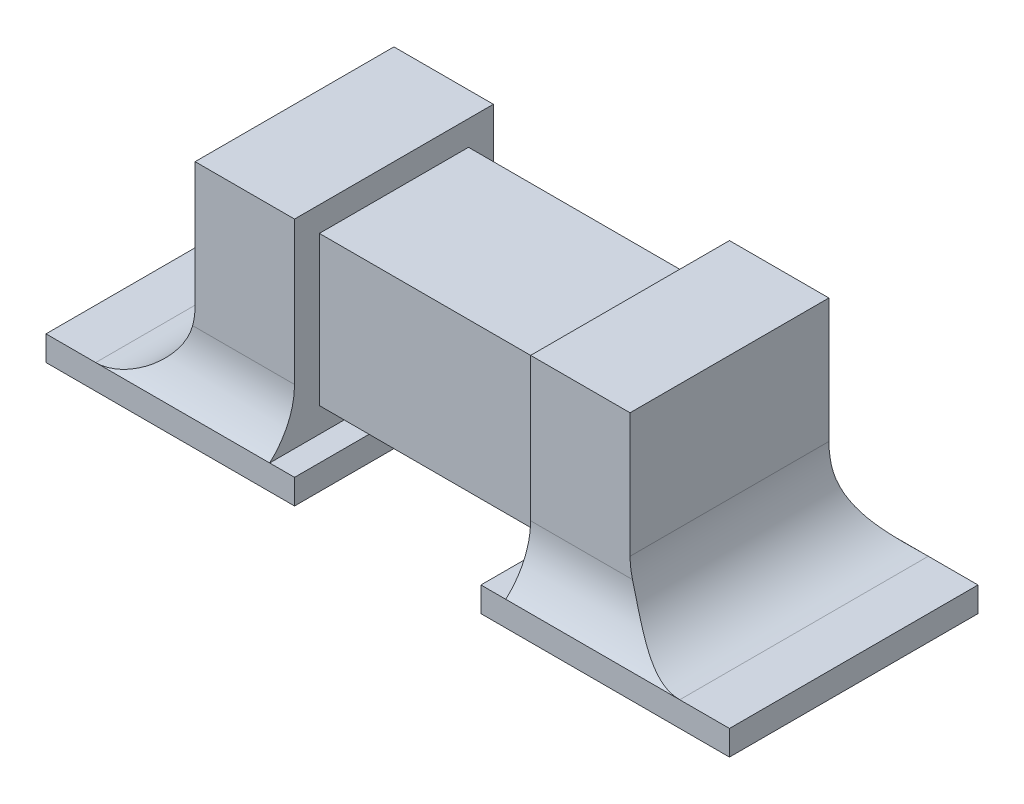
SolidWorks part; units mm, degrees
ref_plane "Plan de face" through (0, 0, 0) normal (0, 0, 1) x (1, 0, 0)
ref_plane "Plan de dessus" through (0, 0, 0) normal (0, 1, 0) x (1, 0, 0)
ref_plane "Plan de droite" through (0, 0, 0) normal (1, 0, 0) x (0, 0, -1)
sketch "Esquisse1" plane through (0, 0, 0) normal (0, 1, 0) x (1, 0, 0)
  line L0 (-0.375, 0) -> (0.375, 0) construction
  line L1 (-0.375, 0.5) -> (-1.375, 0.5)
  line L2 (-0.375, 0.5) -> (-0.375, -0.5)
  line L3 (-0.375, -0.5) -> (-1.375, -0.5)
  line L4 (-1.375, 0.5) -> (-1.375, -0.5)
  line L5 (0.375, 0.5) -> (1.375, 0.5)
  line L6 (0.375, 0.5) -> (0.375, -0.5)
  line L7 (0.375, -0.5) -> (1.375, -0.5)
  line L8 (1.375, 0.5) -> (1.375, -0.5)
  point P10 (0, 0)
  dimension "D1" = 1
  dimension "D2" = 0.75
extrude "Boss.-Extru.1" add sketch "Esquisse1" along normal blind 0.1
sketch "Esquisse3" plane through (0, 0.1, 0) normal (0, 1, 0) x (1, 0, 0)
  line L0 (-0.375, -0.5) -> (-0.375, 0.5) construction
  line L1 (-0.875, 0.4) -> (-0.475, 0.4)
  line L2 (-0.875, 0.4) -> (-0.875, -0.4)
  line L3 (-0.875, -0.4) -> (-0.475, -0.4)
  line L4 (-0.475, 0.4) -> (-0.475, -0.4)
  line L5 (0.475, 0.4) -> (0.875, 0.4)
  line L6 (0.475, 0.4) -> (0.475, -0.4)
  line L7 (0.475, -0.4) -> (0.875, -0.4)
  line L8 (0.875, 0.4) -> (0.875, -0.4)
  line L9 (0.375, 0.5) -> (0.375, -0.5) construction
  point P8 (-0.475, 0)
  dimension "D1" = 0.8
  dimension "D2" = 0.4
  dimension "D3" = 0.1
  dimension "D4" = 0.1
extrude "Boss.-Extru.2" add sketch "Esquisse3" along normal blind 0.8
fillet "Congé1" radius 0.3 3 edges at (-0.675, 0.1, -0.4) (-0.875, 0.1, 0) (-0.675, 0.1, 0.4)
fillet "Congé2" radius 0.3 3 edges at (0.675, 0.1, -0.4) (0.875, 0.1, 0) (0.675, 0.1, 0.4)
sketch "Esquisse4" plane through (-0.475, 0, 0) normal (1, 0, 0) x (0, 0, -1)
  line L0 (-0.4, 0.9) -> (-0.4, 0.4) construction
  line L1 (-0.3, 0.8) -> (0.3, 0.8)
  line L2 (-0.3, 0.8) -> (-0.3, 0.2)
  line L3 (-0.3, 0.2) -> (0.3, 0.2)
  line L4 (0.3, 0.8) -> (0.3, 0.2)
  line L5 (-0.4, 0.9) -> (0.4, 0.9) construction
  line L6 (-0.5, 0.1) -> (0.5, 0.1) construction
  line L7 (0.4, 0.9) -> (0.4, 0.4) construction
  dimension "D1" = 0.1
  dimension "D2" = 0.1
  dimension "D3" = 0.1
  dimension "D4" = 0.1
extrude "Boss.-Extru.3" add sketch "Esquisse4" along normal up to next separate body
